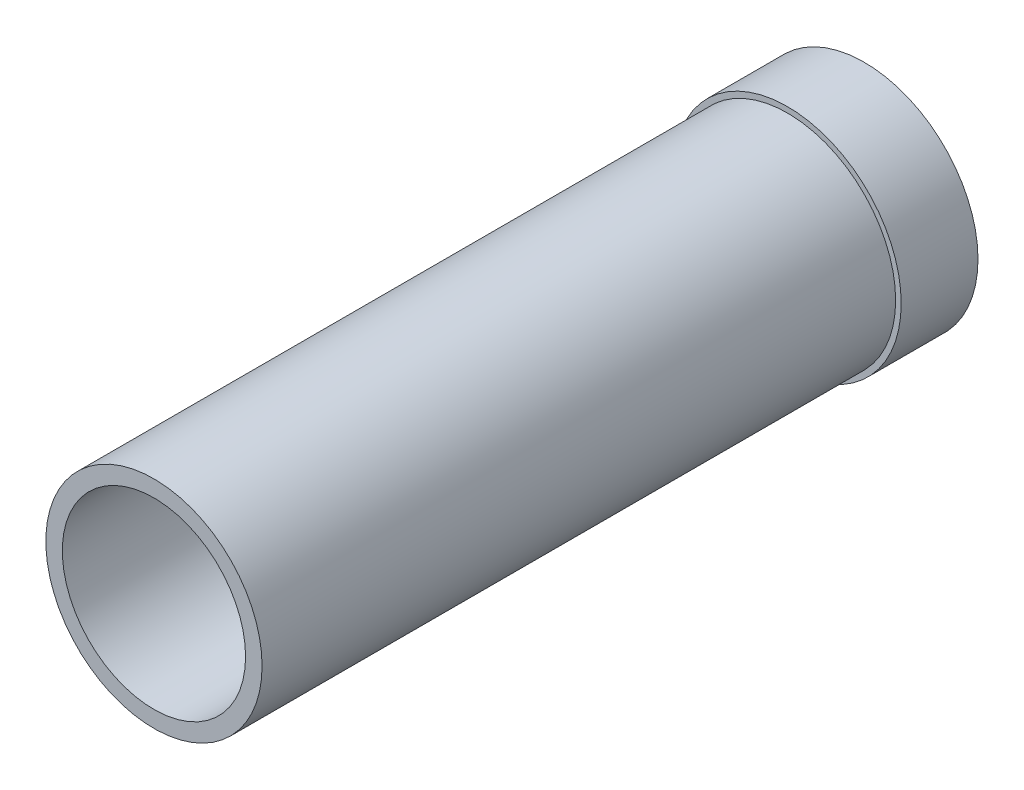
SolidWorks part; units mm, degrees
ref_plane "Front" through (0, 0, 0) normal (0, 0, 1) x (1, 0, 0)
ref_plane "Top" through (0, 0, 0) normal (0, 1, 0) x (1, 0, 0)
ref_plane "Right" through (0, 0, 0) normal (1, 0, 0) x (0, 0, -1)
sketch "Sketch1" plane through (0, 0, 0) normal (0, 0, 1) x (1, 0, 0)
  circle A0 centre (0, 0) radius 13.589
  circle A1 centre (0, 0) radius 11.5164
  dimension "D1" = 27.178
  dimension "D2" = 23.0327
extrude "Extrude1" add sketch "Sketch1" along normal blind 89.281
sketch "Sketch2" plane through (0, 0, 0) normal (0, 0, 1) x (1, 0, 0)
  circle A0 centre (0, 0) radius 14.2875
  dimension "D1" = 28.575
extrude "Extrude2" add sketch "Sketch2" along normal blind 9.652
sketch "Sketch3" plane through (0, 0, 0) normal (0, 0, -1) x (-1, 0, 0)
  circle A0 centre (0, 0) radius 3.175
  dimension "D1" = 6.35
extrude "Extrude3" add sketch "Sketch3" along normal blind 7.366
sketch "Sketch5" plane through (0, 0, -7.366) normal (0, 0, -1) x (-1, 0, 0)
  circle A0 centre (0, 0) radius 0.9652
  dimension "D1" = 1.9304
extrude "Cut-Extrude1" cut sketch "Sketch5" against normal through all
